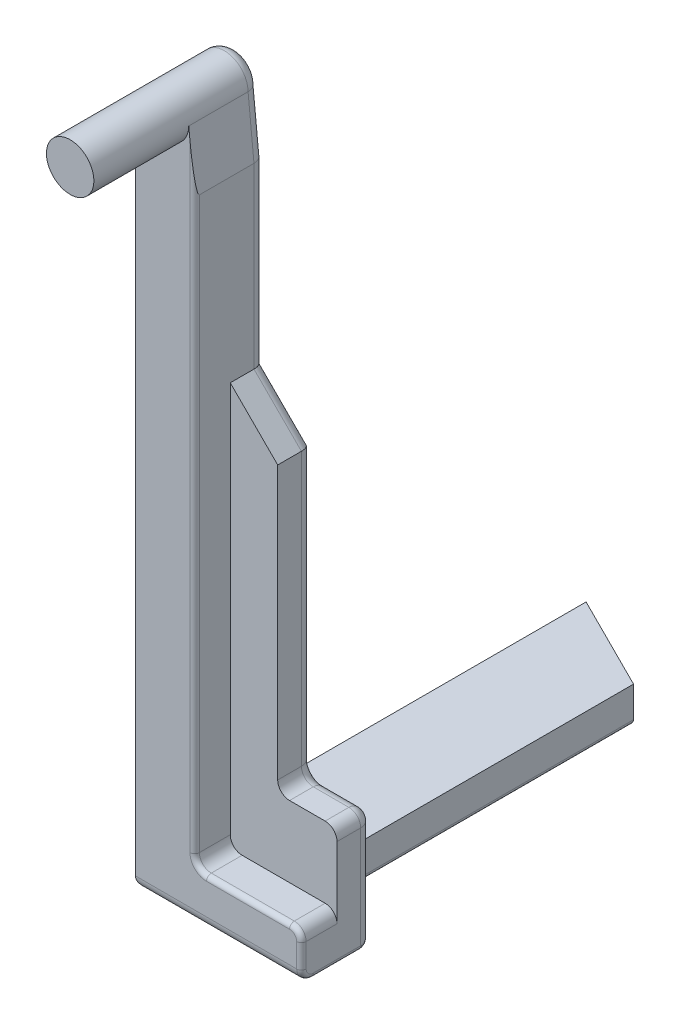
SolidWorks part; units mm, degrees
ref_plane "Plan1" through (0, 0, 0) normal (0, 0, 1) x (1, 0, 0)
ref_plane "Plan2" through (0, 0, 0) normal (0, 1, 0) x (1, 0, 0)
ref_plane "Plan3" through (0, 0, 0) normal (1, 0, 0) x (0, 0, -1)
sketch "Esquisse1" plane through (0, 0, 0) normal (0, 0, 1) x (1, 0, 0)
  line L0 (-30, 40) -> (-30, 10)
  line L1 (-30, 10) -> (-23, 10)
  line L2 (-23, 10) -> (-23, 12)
  line L3 (-23, 12) -> (-27.5, 12)
  line L4 (-27.5, 12) -> (-27.5, 40)
  line L5 (-27.5, 40) -> (-30, 40)
  dimension "D1" = 7
  dimension "D2" = 2.5
  dimension "D3" = 2
  dimension "D4" = 30
extrude "Base-Extrusion" add sketch "Esquisse1" along normal blind 3
sketch "Esquisse2" plane through (0, 0, 3) normal (0, 0, 1) x (1, 0, 0)
  line L0 (-27.5, 12) -> (-27.5, 40) construction
  line L3 (-27.5, 40) -> (-30, 40) construction
  circle A0 centre (-28.75, 39) radius 1
  dimension "D1" = 2
  dimension "D2" = 1.25
extrude "Boss.-Extru.1" add sketch "Esquisse2" along normal blind 4
sketch "Esquisse3" plane through (0, 0, 3) normal (0, 0, 1) x (1, 0, 0)
  line L0 (-30, 36.5127) -> (-30.6466, 36.5127)
  line L1 (-30, 40) -> (-30, 10) construction
  line L2 (-27.75, 39) -> (-27.5, 36.5127)
  line L3 (-27.5, 12) -> (-27.5, 40) construction
  line L4 (-29.75, 39) -> (-30, 36.5127)
  line L5 (-30.6466, 36.5127) -> (-30.6466, 40.4826)
  line L6 (-27.5, 36.5127) -> (-26.6163, 36.5127)
  line L7 (-30.6466, 40.4826) -> (-26.6163, 40.4826)
  line L8 (-26.6163, 40.4826) -> (-26.6163, 36.5127)
  circle A0 centre (-28.75, 39) radius 1 construction
  arc A1 (-27.75, 39) -> (-29.75, 39) centre (-28.75, 39) ccw
extrude "Enlèv. mat.-Extru.1" cut sketch "Esquisse3" against normal through all
sketch "Esquisse5" plane through (0, 0, 0) normal (0, 0, -1) x (-1, 0, 0)
  line L0 (23, 12) -> (23, 15)
  line L1 (23, 15) -> (25.5, 15)
  line L2 (25.5, 15) -> (25.5, 27)
  line L3 (25.5, 27) -> (27.5, 29)
  line L4 (27.5, 12) -> (27.5, 36.5127) construction
  line L5 (27.5, 29) -> (27.5, 12)
  line L6 (27.5, 12) -> (23, 12)
  dimension "D1" = 3
  dimension "D2" = 2.5
  dimension "D3" = 12
  dimension "D4" = 17
extrude "Boss.-Extru.2" add sketch "Esquisse5" against normal blind 1.5
fillet "Congé1" radius 0.5 16 edges at (-26.5, 10, 3) (-23, 12, 2.25) (-30, 10, 1.5) (-30, 23.2564, 0) (-28.75, 40, 0) (-27.625, 37.7564, 0) (-29.875, 37.7564, 0) (-27.5, 32.7564, 0) (-23, 15, 0.75) (-25.5, 15, 0.75) (-26.5, 28, 0) (-25.5, 21, 0) (-24.25, 15, 0) (-23, 12.5, 0) (-26.5, 10, 0) (-27.5, 12, 2.25)
sketch "Esquisse7" plane through (0, 10, 0) normal (0, -1, 0) x (1, 0, 0)
  line L0 (-29.5, 0.5) -> (-29.5, -15.5)
  line L1 (-25.5, 0.5) -> (-25.5, -13.5)
  line L2 (-29.5, 0.5) -> (-23, 0.5) construction
  line L3 (-29.5, 0.5) -> (-25.5, 0.5)
  line L4 (-25.5, -13.5) -> (-29.5, -15.5)
  dimension "D1" = 16
  dimension "D2" = 14
  dimension "D3" = 4
extrude "Boss.-Extru.3" add sketch "Esquisse7" against normal blind 1.5
sketch "Esquisse8" plane through (0.3, 0, -0.6) normal (0.4472, 0, -0.8944) x (-0.8944, 0, -0.4472)
  line L0 (28.8453, 10) -> (28.8229, 8.9323)
  line L1 (28.8229, 8.9323) -> (35.1474, 8.9323)
  line L2 (35.1474, 8.9323) -> (35.1474, 11.5)
  line L3 (35.1474, 11.5) -> (33.3174, 11.5)
  arc A0 (28.8453, 10) -> (33.3174, 11.5) centre (28.9914, 16.9811) ccw
extrude "Enlèv. mat.-Extru.2" cut sketch "Esquisse8" against normal blind 4.5
fillet "Congé3" radius 0.2 14 edges at (-23.1464, 10.1464, 0.1464) (-29.5, 10, -4.9844) (-25.5, 10, -6.5) (-25.6307, 10, -13.5653) (-23, 10, 1.5) (-29.5, 10, 1.5) (-23, 11, 3) (-23, 10.1464, 2.8536) (-27.5, 24.5064, 3) (-25.25, 12, 3) (-23.1464, 11.8536, 3) (-27.3536, 12.1464, 3)
